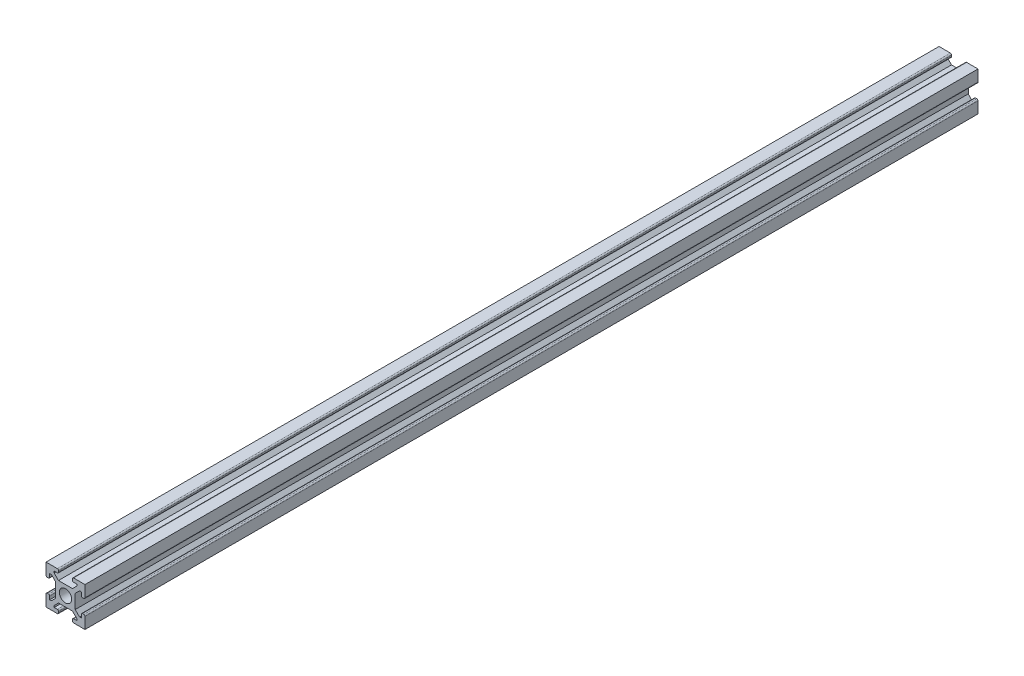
SolidWorks part; units mm, degrees
ref_plane "Front Plane" through (0, 0, 0) normal (0, 0, 1) x (1, 0, 0)
ref_plane "Top Plane" through (0, 0, 0) normal (0, 1, 0) x (1, 0, 0)
ref_plane "Right Plane" through (0, 0, 0) normal (1, 0, 0) x (0, 0, -1)
sketch "Sketch1" plane through (0, 0, 0) normal (0, 0, 1) x (1, 0, 0)
  line L0 (-2.7971, 30.4041) -> (-2.7971, 26.5941)
  line L1 (-29.9673, 30.4041) -> (10.1647, 30.4041)
  line L2 (-29.9673, 30.4041) -> (-29.9673, -9.7279)
  line L3 (-29.9673, -9.7279) -> (10.1647, -9.7279)
  line L4 (10.1647, 30.4041) -> (10.1647, -9.7279)
  line L5 (-29.9673, 30.4041) -> (10.1647, -9.7279) construction
  line L6 (-29.9673, -9.7279) -> (10.1647, 30.4041) construction
  line L7 (-19.9343, 20.3711) -> (0.1317, 20.3711)
  line L8 (-19.9343, 20.3711) -> (-19.9343, 0.3051)
  line L9 (-19.9343, 0.3051) -> (0.1317, 0.3051)
  line L10 (0.1317, 20.3711) -> (0.1317, 0.3051)
  line L11 (-19.9343, 20.3711) -> (0.1317, 0.3051) construction
  line L12 (-19.9343, 0.3051) -> (0.1317, 20.3711) construction
  line L13 (-2.7971, 26.5941) -> (1.7749, 26.5941)
  line L14 (0.1317, 17.5694) -> (4.5767, 22.0144)
  line L15 (4.5767, 22.0144) -> (6.3547, 22.0144)
  line L16 (-2.6701, 20.3711) -> (1.7749, 24.8161)
  line L17 (1.7749, 24.8161) -> (1.7749, 26.5941)
  line L18 (6.3547, 17.4424) -> (6.3547, 22.0144)
  line L19 (10.1647, 17.4424) -> (6.3547, 17.4424)
  line L20 (-9.9013, 30.4041) -> (-9.9013, -9.7279) construction
  line L21 (-29.9673, 10.3381) -> (10.1647, 10.3381) construction
  line L22 (-24.3793, 22.0144) -> (-26.1573, 22.0144)
  line L23 (-29.9673, 17.4424) -> (-26.1573, 17.4424)
  line L24 (-26.1573, 17.4424) -> (-26.1573, 22.0144)
  line L25 (-19.9343, 17.5694) -> (-24.3793, 22.0144)
  line L26 (-17.1325, 20.3711) -> (-21.5775, 24.8161)
  line L27 (-21.5775, 24.8161) -> (-21.5775, 26.5941)
  line L28 (-17.0055, 26.5941) -> (-21.5775, 26.5941)
  line L29 (-17.0055, 30.4041) -> (-17.0055, 26.5941)
  line L30 (10.1647, 3.2339) -> (6.3547, 3.2339)
  line L31 (6.3547, 3.2339) -> (6.3547, -1.3381)
  line L32 (4.5767, -1.3381) -> (6.3547, -1.3381)
  line L33 (0.1317, 3.1069) -> (4.5767, -1.3381)
  line L34 (-2.6701, 0.3051) -> (1.7749, -4.1399)
  line L35 (1.7749, -4.1399) -> (1.7749, -5.9179)
  line L36 (-2.7971, -5.9179) -> (1.7749, -5.9179)
  line L37 (-2.7971, -9.7279) -> (-2.7971, -5.9179)
  line L38 (-17.0055, -9.7279) -> (-17.0055, -5.9179)
  line L39 (-17.0055, -5.9179) -> (-21.5775, -5.9179)
  line L40 (-21.5775, -4.1399) -> (-21.5775, -5.9179)
  line L41 (-17.1325, 0.3051) -> (-21.5775, -4.1399)
  line L42 (-24.3793, -1.3381) -> (-26.1573, -1.3381)
  line L43 (-19.9343, 3.1069) -> (-24.3793, -1.3381)
  line L44 (-26.1573, 3.2339) -> (-26.1573, -1.3381)
  line L45 (-29.9673, 3.2339) -> (-26.1573, 3.2339)
  circle A0 centre (-9.9013, 10.3381) radius 6.35
  point P0 (-9.9013, 10.3381)
  point P5 (-9.9013, 10.3381)
  point P15 (1.7749, 25.7051)
  point P19 (5.4657, 22.0144)
  dimension "D1" = 40.132
  dimension "D2" = 40.132
  dimension "D3" = 20.066
  dimension "D4" = 3.81
  dimension "D5" = 4.572
  dimension "D6" = 1.778
extrude "Boss-Extrude1" add sketch "Sketch1" along normal blind 919.736 contours L29 L1 L2 L23 L24 L22 L25 L8 L7 L26 L27 L28 | L10 L7 L8 L9 A0 | L19 L4 L1 L0 L13 L17 L16 L7 L10 L14 L15 L18 | L37 L3 L4 L30 L31 L32 L33 L10 L9 L34 L35 L36 | L45 L2 L3 L38 L39 L40 L41 L9 L8 L43 L42 L44
fillet "Fillet1" radius 1.27 16 edges at (-29.9673, 3.2339, 459.868) (-26.1573, 3.2339, 459.868) (-17.0055, -9.7279, 459.868) (-17.0055, -5.9179, 459.868) (-2.7971, -9.7279, 459.868) (-2.7971, -5.9179, 459.868) (10.1647, 3.2339, 459.868) (6.3547, 3.2339, 459.868) (10.1647, 17.4424, 459.868) (6.3547, 17.4424, 459.868) (-29.9673, 17.4424, 459.868) (-26.1573, 17.4424, 459.868) (-17.0055, 26.5941, 459.868) (-17.0055, 30.4041, 459.868) (-2.7971, 30.4041, 459.868) (-2.7971, 26.5941, 459.868)
